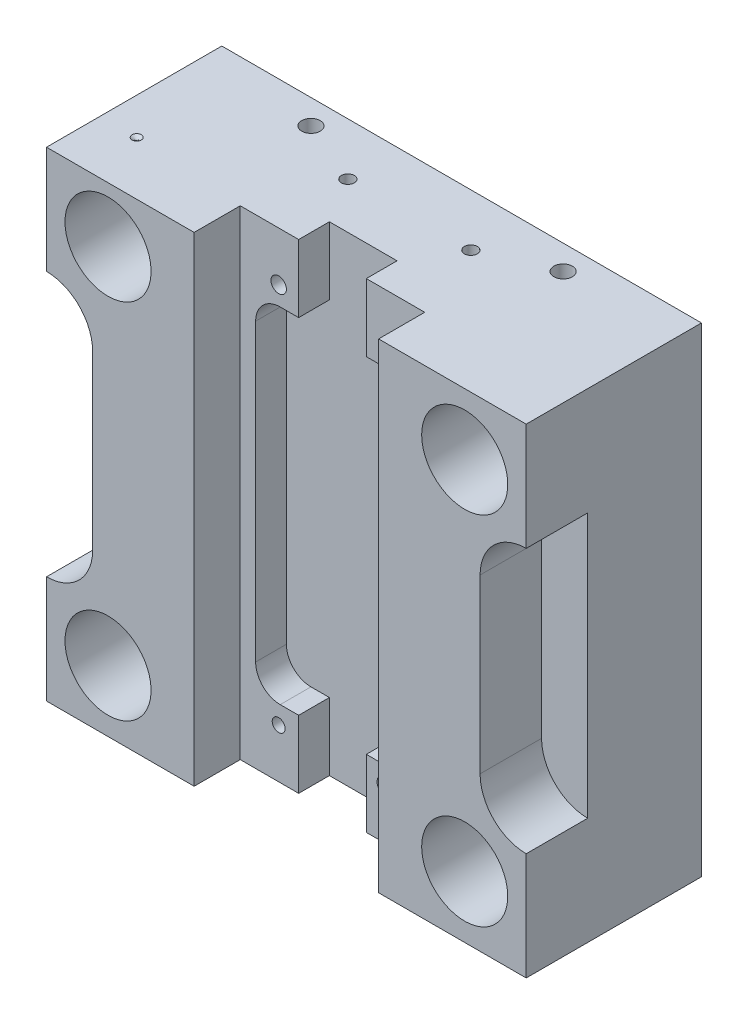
SolidWorks part; units mm, degrees
ref_plane "Plan de face" through (0, 0, 0) normal (0, 0, 1) x (1, 0, 0)
ref_plane "Plan de dessus" through (0, 0, 0) normal (0, 1, 0) x (1, 0, 0)
ref_plane "Plan de droite" through (0, 0, 0) normal (1, 0, 0) x (0, 0, -1)
sketch "Esquisse1" plane through (0, 0, 0) normal (0, 0, 1) x (1, 0, 0)
  line L0 (-78, -78) -> (78, -78)
  line L1 (78, -78) -> (78, 78)
  line L2 (78, 78) -> (-78, 78)
  line L3 (-78, 78) -> (-78, -78)
  circle A0 centre (58, 58) radius 14
  circle A1 centre (58, -58) radius 14
  circle A2 centre (-58, -58) radius 14
  circle A3 centre (-58, 60) radius 14
extrude "Extrusion1" add sketch "Esquisse1" along normal blind 57
sketch "Esquisse2" plane through (0, 0, 57) normal (0, 0, 1) x (1, 0, 0)
  line L0 (-30, -80) -> (30, -80)
  line L1 (30, -80) -> (30, 80)
  line L2 (30, 80) -> (-30, 80)
  line L3 (-30, 80) -> (-30, -80)
extrude "Enlèv. mat.-Extru.1" cut sketch "Esquisse2" against normal blind 15
sketch "Esquisse3" plane through (0, 0, 57) normal (0, 0, 1) x (1, 0, 0)
  line L0 (-63, -28) -> (-63, 28)
  line L1 (-78, 43) -> (-78, -43)
  arc A0 (-78, -43) -> (-63, -28) centre (-78, -28) ccw
  arc A1 (-63, 28) -> (-78, 43) centre (-78, 28) ccw
extrude "Enlèv. mat.-Extru.2" cut sketch "Esquisse3" against normal blind 20
sketch "Esquisse4" plane through (0, 0, 57) normal (0, 0, 1) x (1, 0, 0)
  line L0 (78, -43) -> (78, 43)
  line L1 (63, 28) -> (63, -28)
  arc A0 (78, 43) -> (63, 28) centre (78, 28) ccw
  arc A1 (63, -28) -> (78, -43) centre (78, -28) ccw
extrude "Enlèv. mat.-Extru.3" cut sketch "Esquisse4" against normal blind 20
ref_plane "Plan1" through (0, 0, 57) normal (0, 0, 1) x (1, 0, 0)
sketch "Esquisse5" plane through (0, 0, 0) normal (0, 0, -1) x (-1, 0, 0)
  line L0 (0, -131.4269) -> (0, 111.5833) construction
  line L1 (91.9914, 0) -> (-103.4732, 0) construction
  line L3 (24, 56) -> (-24, 56) construction
  line L4 (25, 55) -> (25, -55) construction
  line L5 (24, -56) -> (-24, -56) construction
  line L6 (-25, 55) -> (-25, -55) construction
  arc A0 (25, 55) -> (24, 56) centre (24, 55) ccw construction
  arc A1 (24, -56) -> (25, -55) centre (24, -55) ccw construction
  arc A2 (-25, -55) -> (-24, -56) centre (-24, -55) ccw construction
  arc A3 (-25, 55) -> (-24, 56) centre (-24, 55) cw construction
  circle A4 centre (-17.5, -62) radius 3.0035
  circle A5 centre (17.5, 62) radius 2.5035
  dimension "D3" = 1
  dimension "D6" = 6.007
  dimension "D7" = 5.007
  dimension "D1" = 112
  dimension "D2" = 50
  dimension "D4" = 17.5
  dimension "D5" = 6
  dimension "D8" = 6
  dimension "D9" = 17.5
extrude "Enlèv. mat.-Extru.4" cut sketch "Esquisse5" against normal through all
hole_wizard "Trou taraudé M5x0.81" positions "Esquisse3D1" profile "Esquisse7" tap size "M5x0.8" standard "Ansi Métrique"
sketch3d "Esquisse3D1"
  line L5 (-17.5, 62, 42) -> (-17.5, 87.7354, 42) construction
  line L6 (-17.5, 62, 42) -> (-17.5, 62, 0) construction
  line L7 (17.5, -62, 42) -> (17.5, -84.7071, 42) construction
  line L8 (17.5, -62, 42) -> (17.5, -62, 0) construction
  line L16 (17.5, -62, 42) -> (-32.8566, -62, 42) construction
  line L17 (-91.9914, 0, 0) -> (103.4732, 0, 0) construction
  line L18 (-17.5, 62, 42) -> (22.2472, 62, 42) construction
  point P0 (-17.5, -62, 42)
  point P2 (17.5, 62, 42)
  dimension "D2" = 35
  dimension "D3" = 35
sketch "Esquisse7" plane through (-17.5, -62, 42) normal (1, 0, 0) x (0, -1, 0)
  line L0 (0, 0) -> (0, 13.6618)
  line L1 (0, 13.6618) -> (2.1, 12.4)
  line L2 (2.1, 12.4) -> (2.1, 0)
  line L5 (2.1, 0) -> (0, 0)
  line L10 (0, 13.6618) -> (-2.1, 12.4) construction
  line L11 (0, -6.35) -> (0, 107.95) construction
  dimension "Diamètre du trou pour taraudage" = 4.2
  dimension "Profondeur du trou pour taraudage" = 12.4
  dimension "Angle de pointe" = 118
sketch "Esquisse8" plane through (0, 0, 42) normal (0, 0, 1) x (1, 0, 0)
  line L0 (-24, -56) -> (24, -56) construction
  line L1 (25, 55) -> (25, -55) construction
  line L2 (-24, 56) -> (24, 56) construction
  line L3 (-25, 55) -> (-25, -55) construction
  line L4 (-17, -56) -> (-11, -56)
  line L5 (25, 48) -> (25, -48)
  line L6 (-17, 56) -> (-11, 56)
  line L7 (-25, 48) -> (-25, -48)
  line L8 (30, 78) -> (-30, 78) construction
  line L9 (-30, -78) -> (30, -78) construction
  line L10 (11, 78) -> (-11, 78)
  line L11 (-11, -78) -> (11, -78)
  line L12 (0, -98.1815) -> (0, 28.3452) construction
  line L13 (-11, 78) -> (-11, 56)
  line L14 (11, 78) -> (11, 56)
  line L15 (11, 56) -> (17, 56)
  line L16 (-11, -56) -> (-11, -78)
  line L17 (11, -56) -> (11, -78)
  line L18 (11, -56) -> (17, -56)
  arc A0 (-25, 48) -> (-17, 56) centre (-17, 48) cw
  arc A1 (-17, -56) -> (-25, -48) centre (-17, -48) cw
  arc A2 (17, -56) -> (25, -48) centre (17, -48) ccw
  arc A3 (17, 56) -> (25, 48) centre (17, 48) cw
  dimension "D1" = 8
  dimension "D2" = 22
extrude "Enlèv. mat.-Extru.5" cut sketch "Esquisse8" against normal blind 10
hole_wizard "Diamètre du perçage Ø3.0 (3)1" positions "Esquisse10" profile "Esquisse9" hole size "Ø3.0" standard "Ansi Métrique"
sketch "Esquisse10" plane through (0, 78, 0) normal (0, 1, 0) x (-1, 0, 0)
  point P0 (66.1023, 39.5719)
sketch "Esquisse9" plane through (-66.1023, 78, 39.5719) normal (1, 0, 0) x (0, 0, 1)
  line L0 (0, 0) -> (0, 0.9023)
  line L1 (0, 0.9023) -> (1.5, 0.001)
  line L2 (1.5, 0.001) -> (1.5, 0)
  line L5 (1.5, 0) -> (0, 0)
  line L10 (0, 0.9023) -> (-1.5, 0.001) construction
  line L11 (0, -6.35) -> (0, 107.95) construction
  dimension "Diamètre du perçage" = 3
  dimension "Profondeur du perçage" = 0.001
  dimension "Angle de pointe" = 118
sketch "Esquisse11" plane through (0, 78, 0) normal (0, 1, 0) x (-1, 0, 0)
  circle A0 centre (41, 8) radius 3.004 construction
  circle A1 centre (41, 8) radius 3.004
  circle A2 centre (-41, 8) radius 3.004 construction
  circle A3 centre (-41, 8) radius 3.004
extrude "Enlèv. mat.-Extru.6" cut sketch "Esquisse11" against normal blind 15
hole_wizard "Trou taraudé M5x0.82" positions "Esquisse13" profile "Esquisse12" tap size "M5x0.8" standard "Ansi Métrique"
sketch "Esquisse13" plane through (0, 78, 0) normal (0, 1, 0) x (-1, 0, 0)
  circle A0 centre (-20, 17) radius 2.75 construction
  circle A1 centre (20, 17) radius 2.75 construction
  point P0 (20, 17)
  point P1 (-20, 17)
sketch "Esquisse12" plane through (-20, 78, 17) normal (1, 0, 0) x (0, 0, 1)
  line L0 (0, 0) -> (0, 13.6618)
  line L1 (0, 13.6618) -> (2.1, 12.4)
  line L2 (2.1, 12.4) -> (2.1, 0)
  line L5 (2.1, 0) -> (0, 0)
  line L10 (0, 13.6618) -> (-2.1, 12.4) construction
  line L11 (0, -6.35) -> (0, 107.95) construction
  dimension "Diamètre du trou pour taraudage" = 4.2
  dimension "Profondeur du trou pour taraudage" = 12.4
  dimension "Angle de pointe" = 118
